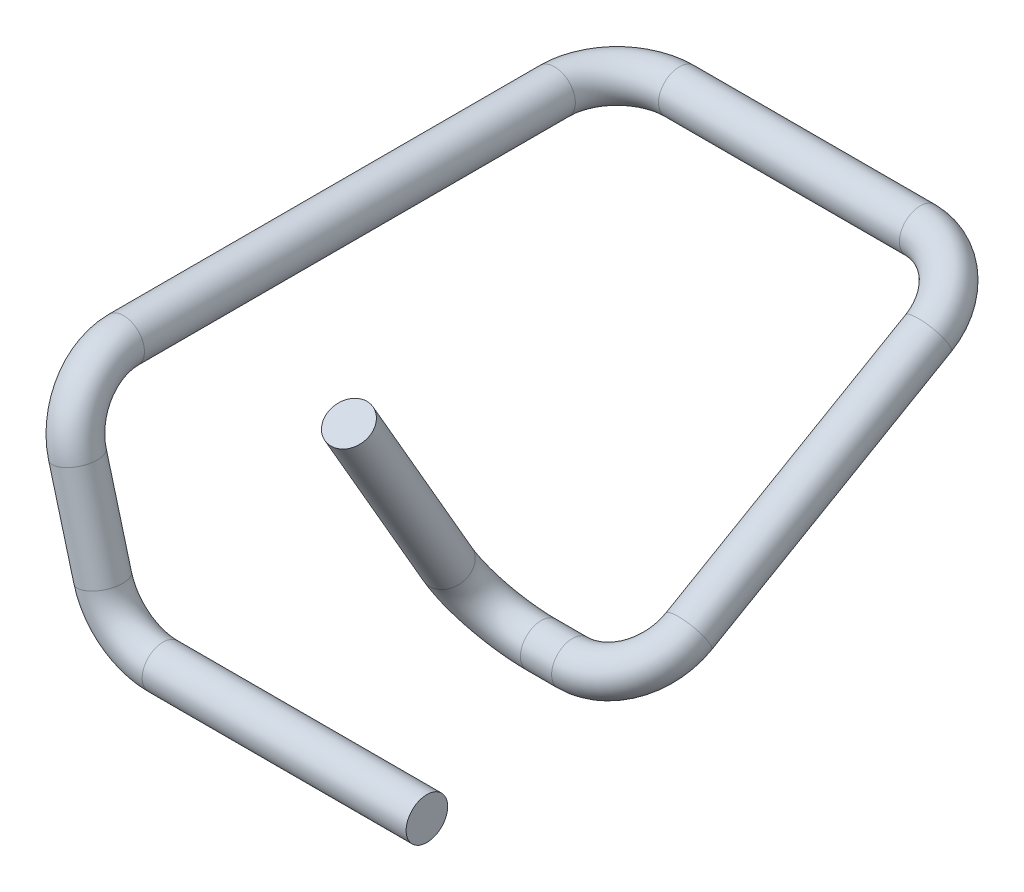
SolidWorks part; units mm, degrees
ref_plane "Front Plane" through (0, 0, 0) normal (0, 0, 1) x (1, 0, 0)
ref_plane "Top Plane" through (0, 0, 0) normal (0, 1, 0) x (1, 0, 0)
ref_plane "Right Plane" through (0, 0, 0) normal (1, 0, 0) x (0, 0, -1)
sketch "setup" plane through (0, 0, 0) normal (0, 1, 0) x (1, 0, 0)
  line L1 (0, 0) -> (-150, 0) construction
  line L2 (0, 0) -> (0, 100) construction
  line L3 (0, 100) -> (-150, 100) construction
  line L4 (-150, 0) -> (-150, 100) construction
  dimension "D1" = 150
  dimension "D2" = 100
ref_plane "Angle 15" through (-139.9519, -37.5, 0) normal (0.9659, 0.2588, 0) x (0, 0, -1)
ref_plane "Angle 60" through (0, -43.3013, -25) normal (0, 0.866, 0.5) x (-1, 0, 0)
sketch3d "3DSketch1"
  line L0 (0, 0, 0) -> (-126.9802, 0, 0)
  line L1 (-155.958, 22.2354, 0) -> (-168.1173, 67.6148, 0)
  line L2 (-175.8819, 96.5926, -30) -> (-175.8819, 96.5926, -237.3033)
  line L3 (-145.8819, 96.5926, -267.3033) -> (-30, 96.5926, -267.3033)
  line L4 (0, 81.5926, -241.3225) -> (0, 15, -125.9808)
  line L5 (-30, 0, -100) -> (-45, 0, -100)
  line L6 (0, 0, -100) -> (-150, 0, -100) construction
  line L7 (-75, 25.9808, -85) -> (-75, 108.2532, -37.5)
  arc A0 (-30, 96.5926, -267.3033) -> (0, 81.5926, -241.3225) centre (-30, 81.5926, -241.3225) ccw
  arc A1 (-126.9802, 0, 0) -> (-155.958, 22.2354, 0) centre (-126.9802, 30, 0) ccw
  arc A2 (-45, 0, -100) -> (-75, 25.9808, -85) centre (-45, 25.9808, -85) ccw
  arc A3 (0, 15, -125.9808) -> (-30, 0, -100) centre (-30, 15, -125.9808) ccw
  arc A4 (-175.8819, 96.5926, -237.3033) -> (-145.8819, 96.5926, -267.3033) centre (-145.8819, 96.5926, -237.3033) ccw
  arc A5 (-168.1173, 67.6148, 0) -> (-175.8819, 96.5926, -30) centre (-168.1173, 67.6148, -30) ccw
  point P15 (0, 96.5926, -267.3033)
  point P16 (-30, 55.6118, -256.3225)
  point P19 (-150, 0, 0)
  point P20 (-126.9802, 30, -30)
  point P23 (-75, 0, -100)
  point P24 (-45, 40.9808, -110.9808)
  point P27 (0, 0, -100)
  point P28 (-30, -10.9808, -140.9808)
  point P31 (-175.8819, 96.5926, -267.3033)
  point P32 (-145.8819, 66.5926, -237.3033)
  point P35 (-175.8819, 96.5926, 0)
  point P36 (-197.0951, 59.8502, -30)
  dimension "D3" = 30
  dimension "D1" = 100
  dimension "D2" = 125
sweep "Sweep1" add path "3DSketch1" parameters "D3"=20
